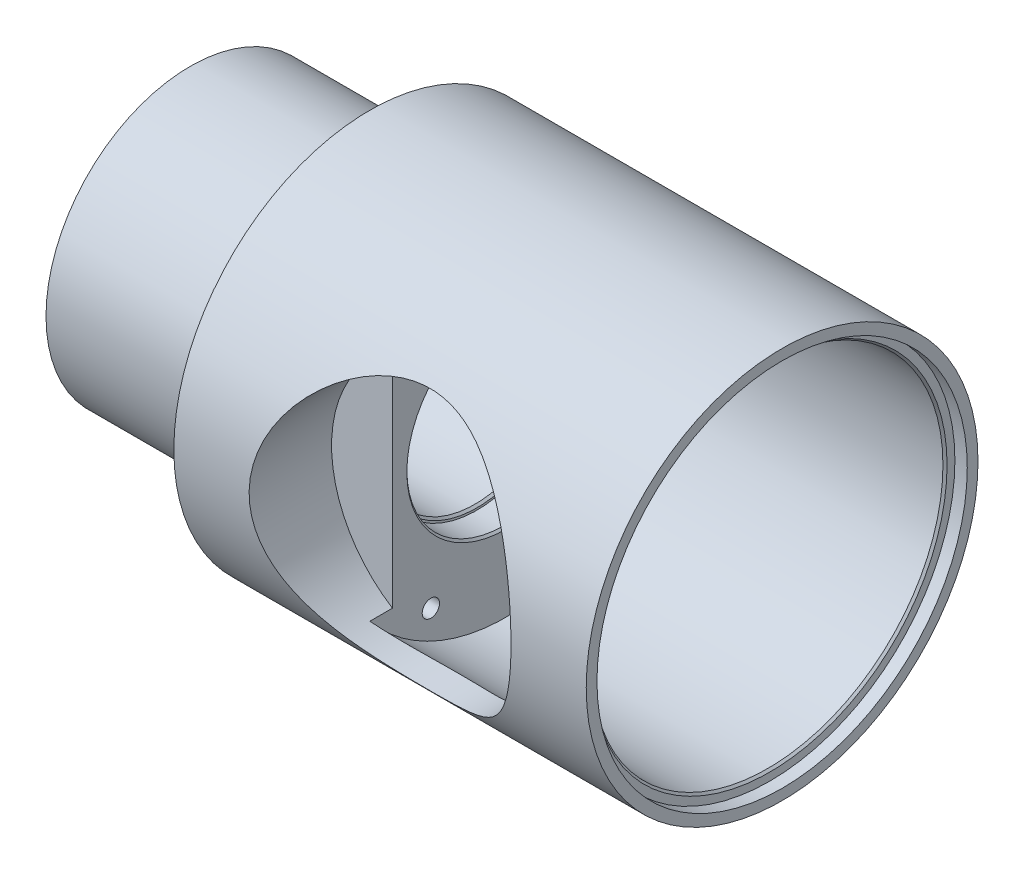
SolidWorks part; units mm, degrees
ref_plane "Front Plane" through (0, 0, 0) normal (0, 0, 1) x (1, 0, 0)
ref_plane "Top Plane" through (0, 0, 0) normal (0, 1, 0) x (1, 0, 0)
ref_plane "Right Plane" through (0, 0, 0) normal (1, 0, 0) x (0, 0, -1)
sketch "Sketch1" plane through (0, 0, 0) normal (1, 0, 0) x (0, 0, -1)
  circle A0 centre (0, 0) radius 42.5
  circle A1 centre (0, 0) radius 47.5
  dimension "D1" = 85
  dimension "D2" = 95
extrude "Boss-Extrude1" add sketch "Sketch1" along normal blind 100
sketch "Sketch3" plane through (0, 0, 0) normal (-1, 0, 0) x (0, 0, 1)
  circle A0 centre (0, 0) radius 42.5
extrude "Boss-Extrude2" add sketch "Sketch3" along normal blind 46 and the other way blind 33
ref_plane "Plane1" through (0, 0, 47.5) normal (0, 0, 1) x (1, 0, 0)
sketch "Sketch4" plane through (0, 0, 47.5) normal (0, 0, 1) x (1, 0, 0)
  circle A0 centre (50, 0) radius 31.75
  dimension "D1" = 63.5
extrude "Cut-Extrude1" cut sketch "Sketch4" against normal blind 20
sketch "Sketch5" plane through (33, 0, 0) normal (1, 0, 0) x (0, 0, -1)
  circle A0 centre (0, 0) radius 23.5
  dimension "D1" = 47
extrude "Cut-Extrude2" cut sketch "Sketch5" against normal blind 7
sketch "Sketch6" plane through (26, 0, 0) normal (1, 0, 0) x (0, 0, -1)
  circle A0 centre (0, 0) radius 22.5
  dimension "D1" = 45
extrude "Cut-Extrude3" cut sketch "Sketch6" against normal blind 35
hole_wizard "M5x0.8 Tapped Hole1" positions "Sketch8" profile "Sketch7" tap size "M5x0.8" standard "Ansi Metric"
sketch "Sketch8" plane through (33, 0, 0) normal (1, 0, 0) x (0, 0, -1)
  point P0 (36.35, 0)
  dimension "D1" = 36.35
sketch "Sketch7" plane through (33, 0, -36.35) normal (0, 1, 0) x (0, 0, -1)
  line L0 (0, 0) -> (0, 15.2618)
  line L1 (0, 15.2618) -> (2.1, 14)
  line L2 (2.1, 14) -> (2.1, 0)
  line L5 (2.1, 0) -> (0, 0)
  line L10 (0, 15.2618) -> (-2.1, 14) construction
  line L11 (0, -6.35) -> (0, 107.95) construction
  dimension "Tap Drill Dia." = 4.2
  dimension "Tap Drill Depth" = 14
  dimension "Drill Angle" = 118
pattern_circular "CirPattern1" count 3 over 360 about axis through (0, 0, 0) along (1, 0, 0) of "M5x0.8 Tapped Hole1"
sketch "Sketch9" plane through (-9, 0, 0) normal (1, 0, 0) x (0, 0, -1)
  circle A0 centre (0, 0) radius 21
  dimension "D1" = 42
extrude "Cut-Extrude4" cut sketch "Sketch9" against normal blind 12
chamfer "Chamfer1" distance 0.5 angle 45 2 edges at (33, 0, -23.5) (26, 0, -22.5)
sketch "Sketch10" plane through (0, 0, 0) normal (-1, 0, 0) x (0, 0, 1)
  circle A0 centre (0, 0) radius 35
extrude "Cut-Extrude5" cut sketch "Sketch10" along normal through all flip side to cut
hole_wizard "M5x0.8 Tapped Hole2" positions "Sketch12" profile "Sketch11" tap size "M5x0.8" standard "Ansi Metric"
sketch "Sketch12" plane through (-46, 0, 0) normal (-1, 0, 0) x (0, 0, 1)
  point P0 (-28, 0)
  point P1 (28, 0)
  dimension "D1" = 28
  dimension "D2" = 28
sketch "Sketch11" plane through (-46, 0, -28) normal (0, 1, 0) x (0, 0, 1)
  line L0 (0, 0) -> (0, 15.2618)
  line L1 (0, 15.2618) -> (2.1, 14)
  line L2 (2.1, 14) -> (2.1, 0)
  line L5 (2.1, 0) -> (0, 0)
  line L10 (0, 15.2618) -> (-2.1, 14) construction
  line L11 (0, -6.35) -> (0, 107.95) construction
  dimension "Tap Drill Dia." = 4.2
  dimension "Tap Drill Depth" = 14
  dimension "Drill Angle" = 118
sketch "Sketch20" plane through (-46, 0, 0) normal (-1, 0, 0) x (0, 0, 1)
  circle A0 centre (0, 0) radius 21
  dimension "D1" = 42
extrude "Cut-Extrude11" cut sketch "Sketch20" against normal blind 23
sketch "Sketch21" plane through (-23, 0, 0) normal (-1, 0, 0) x (0, 0, 1)
  circle A0 centre (0, 0) radius 14
extrude "Cut-Extrude12" cut sketch "Sketch21" against normal up to next
sketch "Sketch22" plane through (-46, 0, 0) normal (-1, 0, 0) x (0, 0, 1)
  circle A0 centre (0, 0) radius 35
extrude "Cut-Extrude13" cut sketch "Sketch22" against normal blind 2.5
sketch "Sketch23" plane through (100, 0, 0) normal (1, 0, 0) x (0, 0, -1)
  circle A0 centre (0, 0) radius 44.9
  dimension "D1" = 89.8
extrude "Cut-Extrude14" cut sketch "Sketch23" against normal blind 3
chamfer "Chamfer2" distance 0.5 angle 45 1 edges at (97, 0, -42.5)
